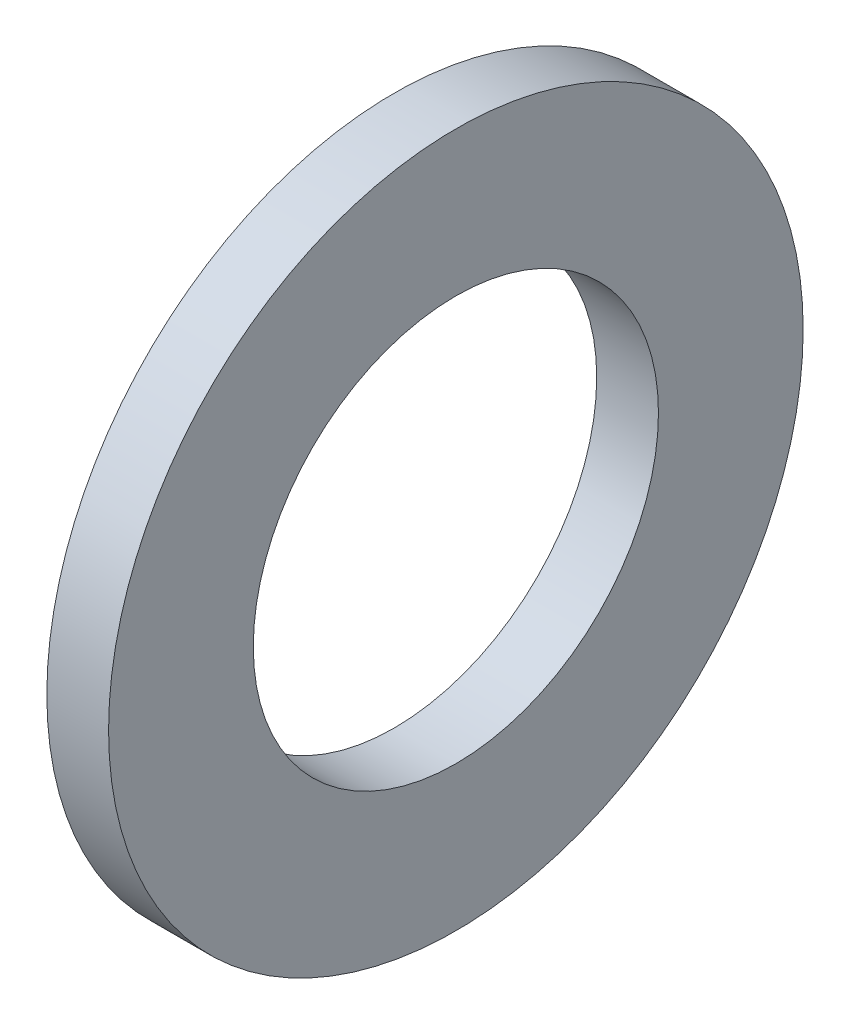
SolidWorks part; units mm, degrees
ref_plane "Plane1" through (0, 0, 0) normal (0, 0, 1) x (1, 0, 0)
ref_plane "Plane2" through (0, 0, 0) normal (0, 1, 0) x (1, 0, 0)
ref_plane "Plane3" through (0, 0, 0) normal (1, 0, 0) x (0, 0, -1)
other "Configuration Table"
sketch "Sketch1" plane through (0, 0, 0) normal (0, 0, 1) x (1, 0, 0)
  line L0 (-34.925, 0) -> (9.525, 0) construction
  line L1 (0, 5.25) -> (0, 9)
  line L2 (0, 9) -> (-1.6, 9)
  line L3 (-1.6, 9) -> (-1.6, 5.25)
  line L4 (-1.6, 5.25) -> (0, 5.25)
  dimension "Thickness" = 1.6
  dimension "Inside_dia" = 10.5
  dimension "Outside_dia" = 18
revolve "Base-Revolve" add sketch "Sketch1" angle 360 about L0
